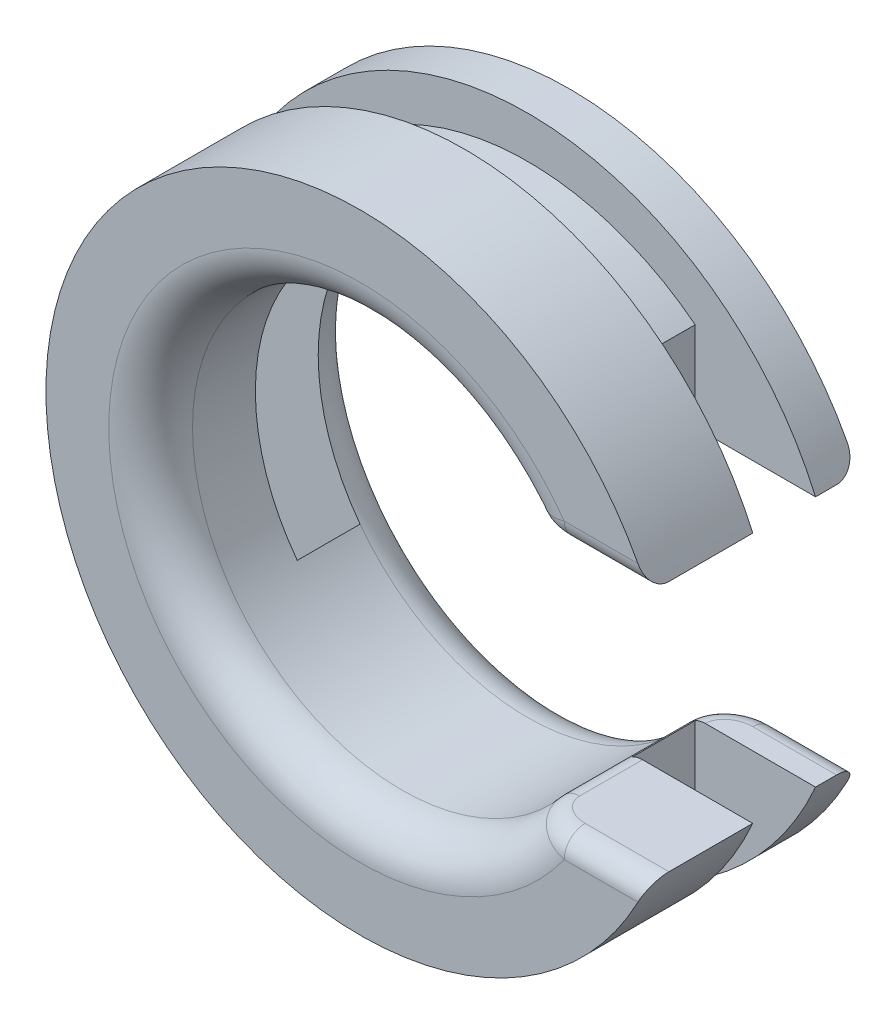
SolidWorks part; units mm, degrees
ref_plane "Front Plane" through (0, 0, 0) normal (0, 0, 1) x (1, 0, 0)
ref_plane "Top Plane" through (0, 0, 0) normal (0, 1, 0) x (1, 0, 0)
ref_plane "Right Plane" through (0, 0, 0) normal (1, 0, 0) x (0, 0, -1)
sketch "Sketch1" plane through (0, 0, 0) normal (1, 0, 0) x (0, 0, -1)
  line L0 (0, 0) -> (51.4192, 0) construction
  line L1 (0, 41.275) -> (9.525, 41.275)
  line L2 (9.525, 41.275) -> (9.525, 47.625)
  line L3 (9.525, 47.625) -> (15.875, 47.625)
  line L4 (15.875, 47.625) -> (15.875, 31.75)
  line L5 (15.875, 31.75) -> (-15.875, 31.75)
  line L6 (-15.875, 31.75) -> (-15.875, 47.625)
  line L7 (-15.875, 47.625) -> (0, 47.625)
  line L8 (0, 47.625) -> (0, 41.275)
  point P5 (0, 31.75)
  dimension "D1" = 82.55
  dimension "D2" = 63.5
  dimension "D3" = 6.35
  dimension "D4" = 15.875
  dimension "D5" = 9.525
  dimension "D6" = 6.35
revolve "Revolve1" add sketch "Sketch1" angle 360 about L0
fillet "Fillet1" radius 6.35 2 edges at (31.75, 0, -15.875) (31.75, 0, 15.875)
sketch "Sketch2" plane through (0, 0, 15.875) normal (0, 0, 1) x (1, 0, 0)
  line L1 (47.625, -19.05) -> (47.625, 19.05)
  line L5 (47.625, 19.05) -> (0, 19.05)
  line L6 (0, 0) -> (0, 70.1991) construction
  line L7 (0, 19.05) -> (0, 0)
  line L8 (47.625, -19.05) -> (0, -19.05)
  line L9 (0, -19.05) -> (0, 0)
  line L10 (-41.275, 62.6392) -> (-41.275, -70.6439) construction
  circle A0 centre (0, 0) radius 47.625 construction
  circle A3 centre (0, 0) radius 41.275 construction
  point P2 (0, 19.05)
  dimension "D3" = 38.1
extrude "Cut-Extrude1" cut sketch "Sketch2" against normal through all
sketch "Sketch3" [suppressed] plane through (25.4, 0, 0) normal (1, 0, 0) x (0, 0, -1)
  line L0 (-15.875, 47.625) -> (-15.875, 31.75) construction
  line L2 (-9.525, 39.6875) -> (-9.525, -39.6875) construction
  line L3 (0, 0) -> (-9.525, 0) construction
  circle A0 centre (-9.525, 39.6875) radius 3.175
  circle A1 centre (-9.525, -39.6875) radius 3.175
  dimension "D1" = 6.35
  dimension "D2" = 79.375
  dimension "D3" = 6.35
extrude "Cut-Extrude2" [suppressed] cut sketch "Sketch3" against normal blind 15.875
fillet "Fillet2" [suppressed] radius 3.175
fillet "Fillet3" radius 3.175 10 edges at (38.3223, -19.05, -15.875) (38.3223, 19.05, -15.875) (38.2652, -19.05, -5.1952) (37.9735, 19.05, -4.9312) (37.9735, -19.05, 4.9312) (38.3223, 19.05, 15.875) (38.3223, -19.05, 15.875) (38.2652, 19.05, 5.1952) (25.4, -19.05, 0) (25.4, 19.05, 0)
hole_wizard "Hole1" positions "Sketch5" profile "Sketch4" legacy
sketch "Sketch5" plane through (0, 0, -15.875) normal (0, 0, -1) x (-1, 0, 0)
  line L0 (47.625, 0) -> (0, 0) construction
  point P0 (47.625, 0)
  dimension "D1" = 47.625
sketch "Sketch4" plane through (-47.625, 0, -15.875) normal (1, 0, 0) x (0, 1, 0)
  line L0 (0, 0) -> (0, 33.284)
  line L1 (0, 33.284) -> (3.175, 33.284)
  line L2 (3.175, 33.284) -> (3.175, 0)
  line L3 (3.175, 0) -> (0, 0)
  line L4 (0, 110) -> (0, -10) construction
  dimension "Diameter" = 6.35
  dimension "Depth" = 33.284
sketch "Sketch6" [suppressed] plane through (0, 0, 15.875) normal (0, 0, 1) x (1, 0, 0)
  line L0 (25.4, 64.5079) -> (25.4, -98.3613) construction
  line L1 (-41.275, 72.7787) -> (-41.275, -91.9314) construction
  line L2 (25.4, 47.625) -> (25.4, 34.925) construction
  arc A0 (36.6159, 19.05) -> (36.6159, -19.05) centre (0, 0) ccw construction
  dimension "D1" = 66.675
sketch "Sketch7" plane through (0, 0, 0) normal (0, 1, 0) x (1, 0, 0)
  line L0 (-47.625, 9.525) -> (43.649, 9.525) construction
  line L1 (43.649, 0) -> (25.4, 0)
  line L2 (43.649, 0) -> (43.649, 9.525)
  line L3 (43.649, 9.525) -> (25.4, 9.525)
  line L4 (25.4, 0) -> (25.4, 9.525)
  line L5 (43.649, 0) -> (-47.625, 0) construction
  line L6 (43.649, 0) -> (43.649, -12.7) construction
  line L7 (-47.625, 0) -> (-47.625, -15.875) construction
  line L8 (-47.625, 0) -> (-25.4, 0)
  line L9 (-47.625, 0) -> (-47.625, 9.525)
  line L10 (-47.625, 9.525) -> (-25.4, 9.525)
  line L11 (-25.4, 0) -> (-25.4, 9.525)
  dimension "D1" = 25.4
  dimension "D2" = 50.8
extrude "Cut-Extrude3" cut sketch "Sketch7" against normal mid plane 152.4
